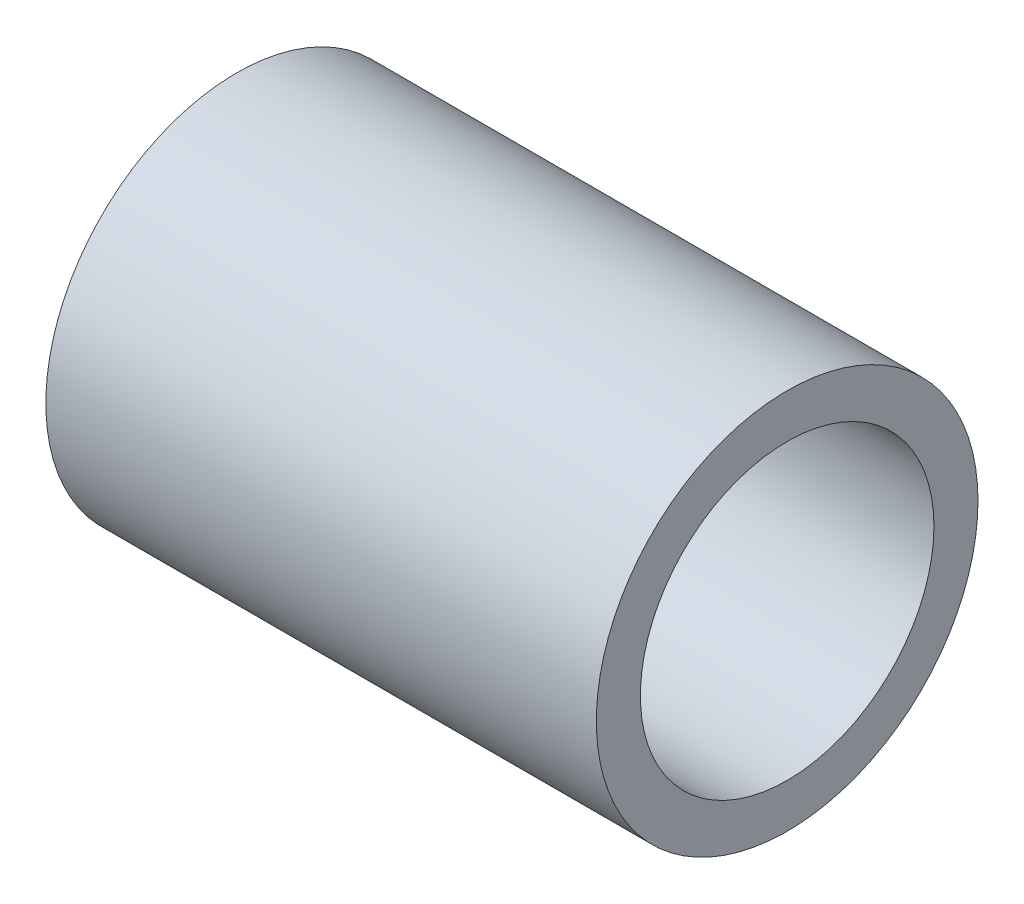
SolidWorks part; units mm, degrees
ref_plane "Front" through (0, 0, 0) normal (0, 0, 1) x (1, 0, 0)
ref_plane "Top" through (0, 0, 0) normal (0, 1, 0) x (1, 0, 0)
ref_plane "Right" through (0, 0, 0) normal (1, 0, 0) x (0, 0, -1)
sketch "Sketch1" plane through (0, 0, 0) normal (0, 0, 1) x (1, 0, 0)
  line L0 (0, 0) -> (47.625, 0)
  line L1 (9.9848, 0) -> (-9.9848, 0) construction
  dimension "D1" = 47.625
other "Structural Member1"
ref_plane "Plane1" through (0, 0, 0) normal (1, 0, 0) x (0, 0, -1)
sketch "Sketch11" plane through (0, 0, 0) normal (1, 0, 0) x (0, 0, -1)
  circle A0 centre (0, 0) radius 12.7
  circle A1 centre (0, 0) radius 16.51
  point P3 (0, 0)
  dimension "D1" = 33.02
  dimension "D2" = 25.4
